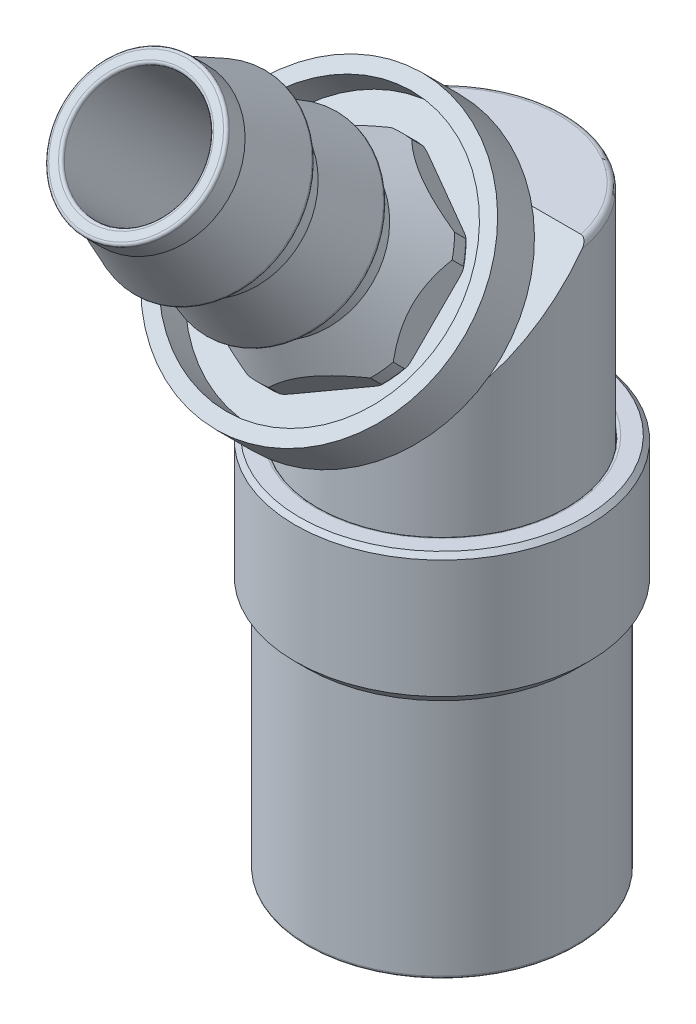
SolidWorks part; units mm, degrees
other "BODY_"
ref_plane "Front Plane" through (0, 0, 0) normal (0, 0, 1) x (1, 0, 0)
ref_plane "Top Plane" through (0, 0, 0) normal (0, 1, 0) x (1, 0, 0)
ref_plane "Right Plane" through (0, 0, 0) normal (1, 0, 0) x (0, 0, -1)
imported_body "PL-BARB"
imported_body "BARB"
imported_body "SC200S"
imported_body "BODY"
imported_body "SLEEVE"
sketch "Sketch2" plane through (0, 0, 0) normal (0, 0, 1) x (1, 0, 0)
  line L0 (-6.7437, 13.0794) -> (-6.7437, 1.016)
  line L1 (-6.7437, 1.016) -> (-4.7625, 2.9972)
  line L2 (-4.7625, 2.9972) -> (-4.7625, 11.1863)
  line L3 (-4.7625, 11.1863) -> (-6.7437, 13.0794)
  line L4 (0, 0) -> (0, 12.1017) construction
  line L5 (0, 13.0794) -> (0, 1.016) construction
  line L6 (-7.0834, 13.404) -> (-6.7437, 13.0794) construction
  line L7 (-6.7437, 1.016) -> (-7.7597, 0) construction
  dimension "D1" = 9.525
revolve "Revolve1" add sketch "Sketch2" angle 360 about L4
sketch "Sketch1" plane through (0, 0, 0) normal (0, -1, 0) x (1, 0, 0)
  line L1 (6.477, 3.7395) -> (0, 7.479)
  line L2 (0, 7.479) -> (-6.477, 3.7395)
  line L3 (-6.477, 3.7395) -> (-6.477, -3.7395)
  line L4 (-6.477, -3.7395) -> (0, -7.479)
  line L5 (0, -7.479) -> (6.477, -3.7395)
  line L6 (6.477, -3.7395) -> (6.477, 3.7395)
  circle A0 centre (0, 0) radius 6.477 construction
  dimension "D1" = 12.954
extrude "Cut-Extrude1" cut sketch "Sketch1" against normal up to surface (15.5119 mm away)
